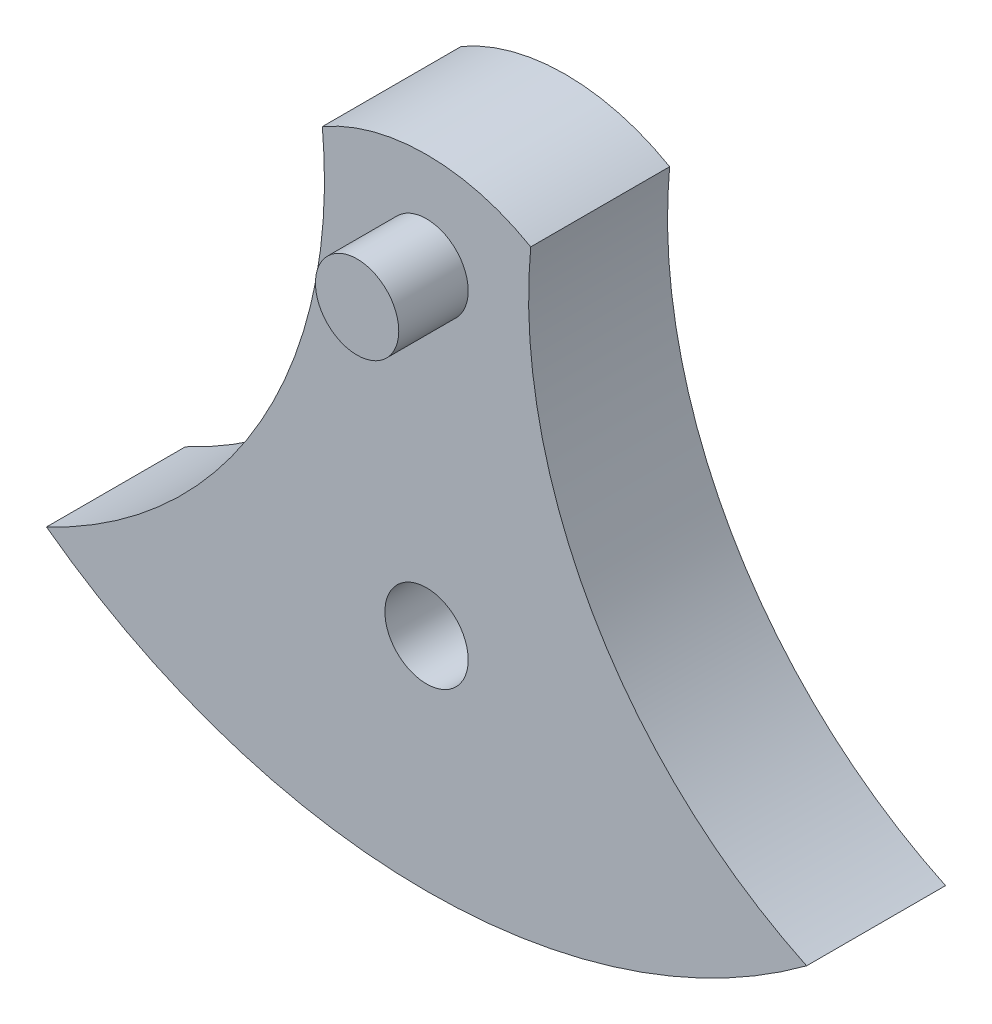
SolidWorks part; units mm, degrees
ref_plane "Front Plane" through (0, 0, 0) normal (0, 0, 1) x (1, 0, 0)
ref_plane "Top Plane" through (0, 0, 0) normal (0, 1, 0) x (1, 0, 0)
ref_plane "Right Plane" through (0, 0, 0) normal (1, 0, 0) x (0, 0, -1)
sketch "Sketch1" plane through (0, 0, 0) normal (0, 0, 1) x (1, 0, 0)
sketch_block_instance "Block-Crank-1"
sketch_block "Block-Crank" parameters "D3"=35, "D5"=46, "D6"=15, "D8"=6, "D7"=23, "D1"=60, "D2"=70, "D4"=73
extrude "Boss-Extrude1" add sketch "Sketch1" against normal blind 10
extrude "Boss-Extrude2" add sketch "Sketch1<3>" along normal blind 5 separate body
sketch "Sketch1<3>"
